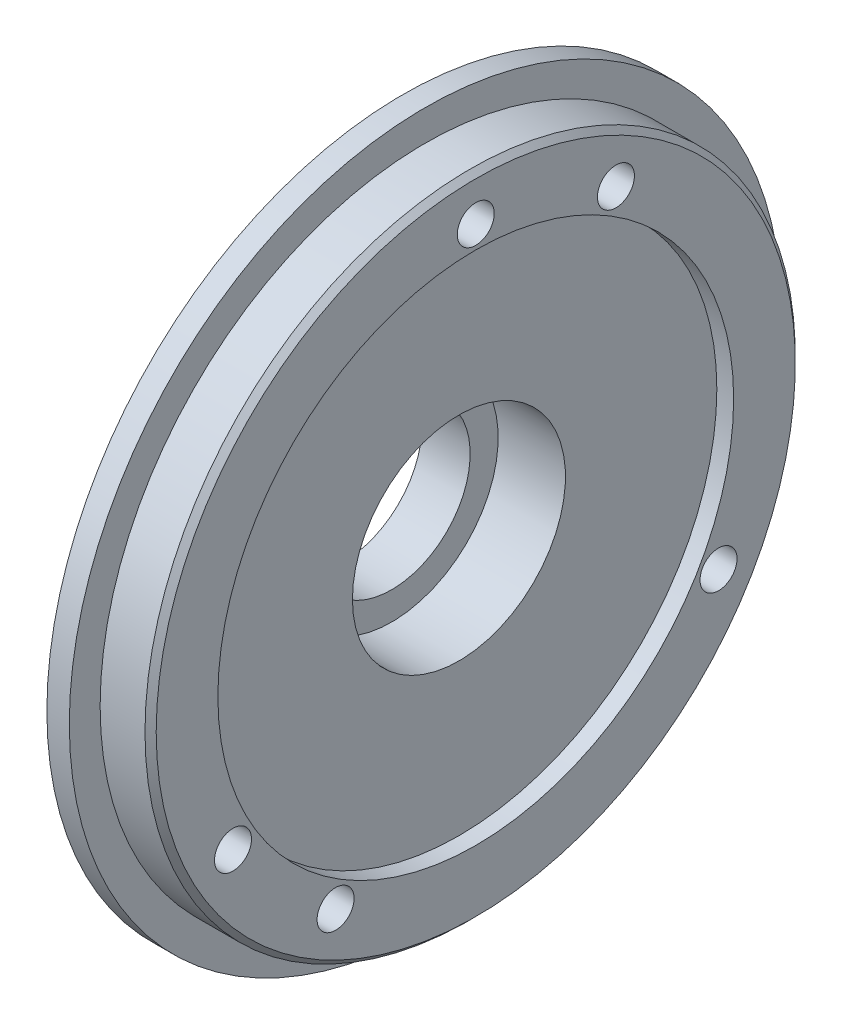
SolidWorks part; units mm, degrees
ref_plane "Face" through (0, 0, 0) normal (0, 0, 1) x (1, 0, 0)
ref_plane "Dessus" through (0, 0, 0) normal (0, 1, 0) x (1, 0, 0)
ref_plane "Droite" through (0, 0, 0) normal (1, 0, 0) x (0, 0, -1)
sketch "Esquisse1" plane through (0, 0, 0) normal (0, 0, 1) x (1, 0, 0)
  line L0 (0, 0) -> (77.5182, 0) construction
  line L1 (3, 0) -> (3, 23)
  line L2 (3, 23) -> (4.5, 23)
  line L3 (4.5, 23) -> (4.5, 29)
  line L4 (4.5, 29) -> (0, 29)
  line L5 (0, 29) -> (0, 31.75)
  line L6 (0, 31.75) -> (-2, 31.75)
  line L7 (-2, 31.75) -> (-2, 29)
  line L8 (-2, 29) -> (-3.5, 29)
  line L9 (-3.5, 29) -> (-3.5, 20.5)
  line L10 (-3.5, 20.5) -> (-2, 20.5)
  line L11 (-2, 20.5) -> (-2, 14)
  line L12 (-2, 14) -> (-7.3, 14)
  line L13 (-7.3, 14) -> (-7.3, 0)
  line L14 (-7.3, 0) -> (3, 0)
  line L15 (53, 29) -> (0, 29) construction
  line L16 (0, 33) -> (0, -33) construction
  dimension "D1" = 4.5
  dimension "D2" = 1.5
  dimension "D3" = 1.5
  dimension "D4" = 63.5
  dimension "D5" = 41
  dimension "D6" = 28
  dimension "D7" = 3.8
  dimension "D8" = 2
  dimension "D9" = 46
revolve "Révolution1" add sketch "Esquisse1" angle 360 about L0
hole_wizard "Trou taraudé M4x0.71" positions "Esquisse3" profile "Esquisse2" tap size "M4x0.7" standard "ISO"
sketch "Esquisse3" plane through (-3.5, 0, 0) normal (-1, 0, 0) x (0, 0, 1)
  point P0 (0, 25)
  dimension "D1" = 25
sketch "Esquisse2" plane through (-3.5, 25, 0) normal (0, 1, 0) x (0, 0, 1)
  line L0 (0, 0) -> (0, 12.4526)
  line L1 (0, 12.4526) -> (1.65, 11.5)
  line L2 (1.65, 11.5) -> (1.65, 0)
  line L5 (1.65, 0) -> (0, 0)
  line L10 (0, 12.4526) -> (-1.65, 11.5) construction
  line L11 (0, -6.35) -> (0, 107.95) construction
  dimension "Diamètre du trou pour taraudage" = 3.3
  dimension "Profondeur du trou pour taraudage" = 11.5
  dimension "Angle de pointe" = 120
pattern_circular "Répétition circulaire1" count 3 every 120 about axis through (0, 0, 0) along (1, 0, 0)
hole_wizard "Trou taraudé M4x0.72" positions "Esquisse5" profile "Esquisse4" tap size "M4x0.7" standard "ISO"
sketch "Esquisse5" plane through (-3.5, 0, 0) normal (-1, 0, 0) x (0, 0, 1)
  line L0 (0, 0) -> (-17.6246, 30.5267) construction
  line L1 (0, -6.195) -> (0, 6.195) construction
  point P0 (-12.5, 21.6506)
  dimension "D1" = 25
  dimension "D2" = 30
sketch "Esquisse4" plane through (-3.5, 21.6506, -12.5) normal (0, 1, 0) x (0, 0, 1)
  line L0 (0, 0) -> (0, 8)
  line L1 (0, 8) -> (1.65, 8)
  line L2 (1.65, 8) -> (1.65, 0)
  line L5 (1.65, 0) -> (0, 0)
  line L11 (0, -6.35) -> (0, 107.95) construction
  dimension "Diamètre du trou pour taraudage jusqu'au prochain" = 3.3
  dimension "Profondeur du trou pour taraudage jusqu'au prochain" = 8
pattern_circular "Répétition circulaire2" count 2 every 180 about axis through (0, 0, 0) along (1, 0, 0)
chamfer "Chanfrein1" distance 0.5 angle 45
chamfer "Chanfrein2" distance 0.5 angle 45
sketch "Esquisse6" plane through (-7.3, 0, 0) normal (-1, 0, 0) x (0, 0, 1)
  circle A0 centre (0, 0) radius 7
  dimension "D1" = 14
extrude "Enlèv. mat.-Extru.1" cut sketch "Esquisse6" against normal through all
sketch "Esquisse7" plane through (0, 0, 0) normal (0, 0, 1) x (1, 0, 0)
  line L0 (0, 0) -> (21.5817, 0) construction
  line L1 (3, 0) -> (-3, 0)
  line L2 (3, 0) -> (3, 9.5)
  line L3 (3, 9.5) -> (-3, 9.5)
  line L4 (-3, 0) -> (-3, 9.5)
  line L6 (3, -23) -> (3, 23) construction
  dimension "D1" = 19
  dimension "D2" = 6
revolve "Enlèvement de matière-Révolution1" cut sketch "Esquisse7" angle 360 about L0
hole_wizard "Trou taraudé M2.5x0.451" positions "Esquisse11" profile "Esquisse10" tap size "M2.5x0.45" standard "ISO"
sketch "Esquisse11" plane through (-7.3, 0, 0) normal (-1, 0, 0) x (0, 0, 1)
  line L0 (0, -6.195) -> (0, 6.195) construction
  point P0 (0, 11)
  dimension "D1" = 11
sketch "Esquisse10" plane through (-7.3, 11, 0) normal (0, 1, 0) x (0, 0, 1)
  line L0 (0, 0) -> (0, 8.8418)
  line L1 (0, 8.8418) -> (1.025, 8.25)
  line L2 (1.025, 8.25) -> (1.025, 0)
  line L5 (1.025, 0) -> (0, 0)
  line L10 (0, 8.8418) -> (-1.025, 8.25) construction
  line L11 (0, -6.35) -> (0, 107.95) construction
  dimension "Diamètre du trou pour taraudage" = 2.05
  dimension "Profondeur du trou pour taraudage" = 8.25
  dimension "Angle de pointe" = 120
pattern_circular "Répétition circulaire3" count 3 every 120 about axis through (0, 0, 0) along (1, 0, 0)
